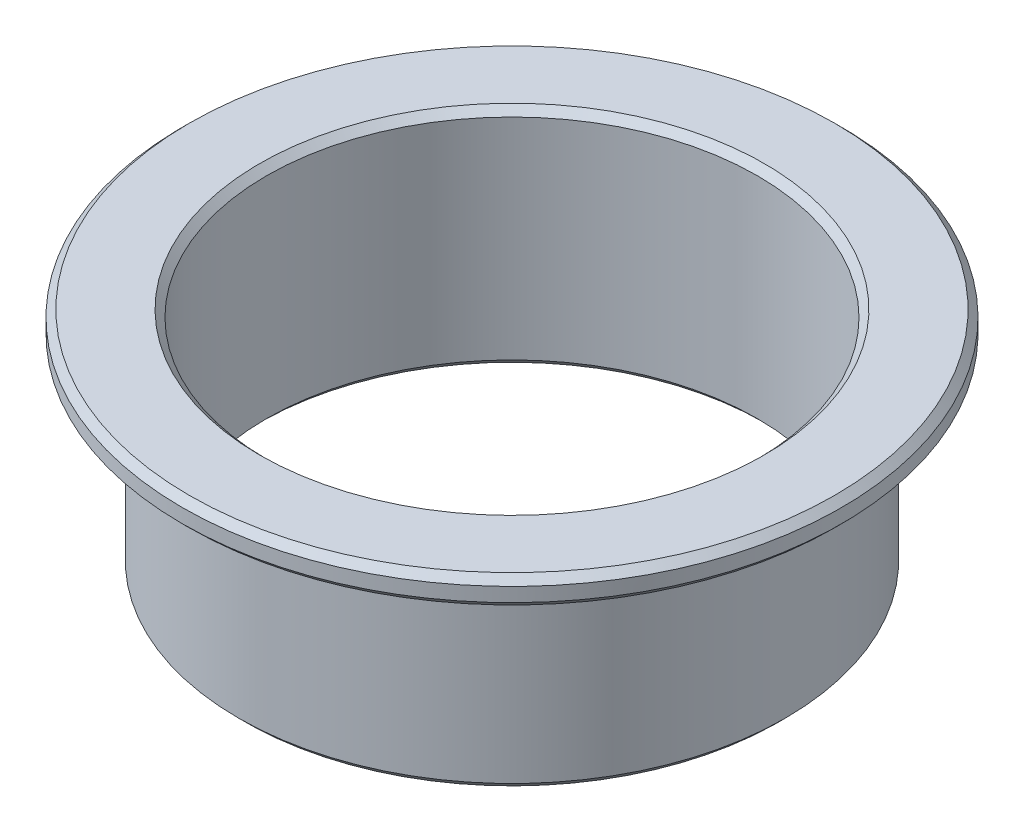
SolidWorks part; units mm, degrees
ref_plane "Plan de face" through (0, 0, 0) normal (0, 0, 1) x (1, 0, 0)
ref_plane "Plan de dessus" through (0, 0, 0) normal (0, 1, 0) x (1, 0, 0)
ref_plane "Plan de droite" through (0, 0, 0) normal (1, 0, 0) x (0, 0, -1)
sketch "Esquisse1" plane through (0, 0, 0) normal (0, 0, 1) x (1, 0, 0)
  line L0 (0, 32.8285) -> (0, -29.3423) construction
  line L1 (-17.5, -7.7513) -> (-19.5, -7.7513)
  line L2 (-17.5, -7.7513) -> (-17.5, 8.2487)
  line L3 (-17.5, 8.2487) -> (-23.5, 8.2487)
  line L4 (-23.5, 8.2487) -> (-23.5, 6.2487)
  line L5 (-23.5, 6.2487) -> (-19.5, 6.2487)
  line L6 (-19.5, 6.2487) -> (-19.5, -7.7513)
  dimension "D1" = 17.5
  dimension "D2" = 2
  dimension "D3" = 16
  dimension "D4" = 6
  dimension "D5" = 2
  dimension "D6" = 4
revolve "Révolution1" add sketch "Esquisse1" angle 360 about L0
fillet "Congé1" radius 1 1 edges at (0, 6.2487, 19.5)
chamfer "Chanfrein1" distance 0.5 angle 45 5 edges at (0, 8.2487, 23.5) (0, 6.2487, 23.5) (0, -7.7513, 17.5) (0, -7.7513, 19.5) (0, 8.2487, 17.5)
